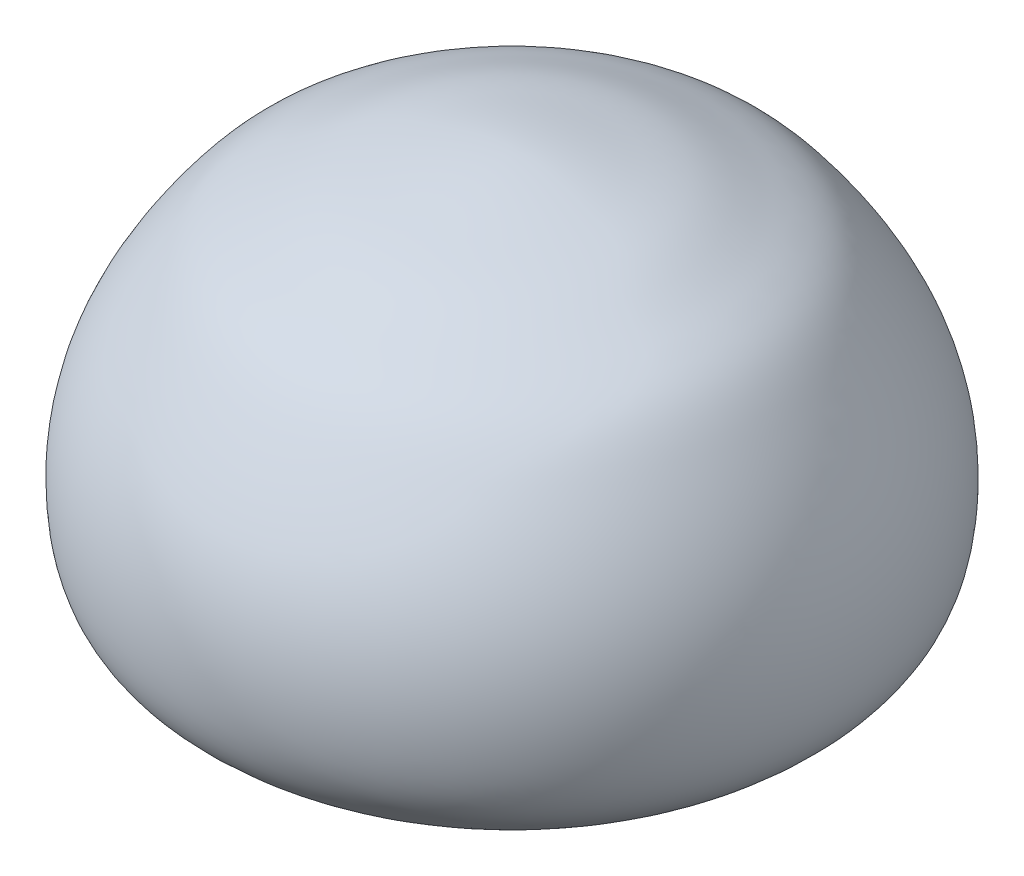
SolidWorks part; units mm, degrees
ref_plane "Plan de face" through (0, 0, 0) normal (0, 0, 1) x (1, 0, 0)
ref_plane "Plan de dessus" through (0, 0, 0) normal (0, 1, 0) x (1, 0, 0)
ref_plane "Plan de droite" through (0, 0, 0) normal (1, 0, 0) x (0, 0, -1)
sketch "Esquisse1" plane through (0, 0, 0) normal (0, 0, 1) x (1, 0, 0)
  line L0 (569.2864, 369.0579) -> (601.2145, 369.0579)
  line L1 (601.2145, 369.0579) -> (601.2145, 424.0855)
  spline S0 degree 3 poles (569.2864, 369.0579) (565.4726, 370.2493) (558.4877, 374.0503) (556.3111, 385.3889) (557.8577, 397.3436) (563.7199, 407.3083) (570.1302, 415.1091) (576.6636, 417.9076) (582.8823, 420.8941) (590.988, 422.7566) (597.2237, 424.0627) (601.2145, 424.0855) knots 0 0 0 0 0.075881 0.125133 0.19893 0.290924 0.330647 0.378894 0.416865 0.455565 0.529347 0.529347 0.529347 0.529347
revolve "Révolution1" add sketch "Esquisse1" angle 360 about L1
